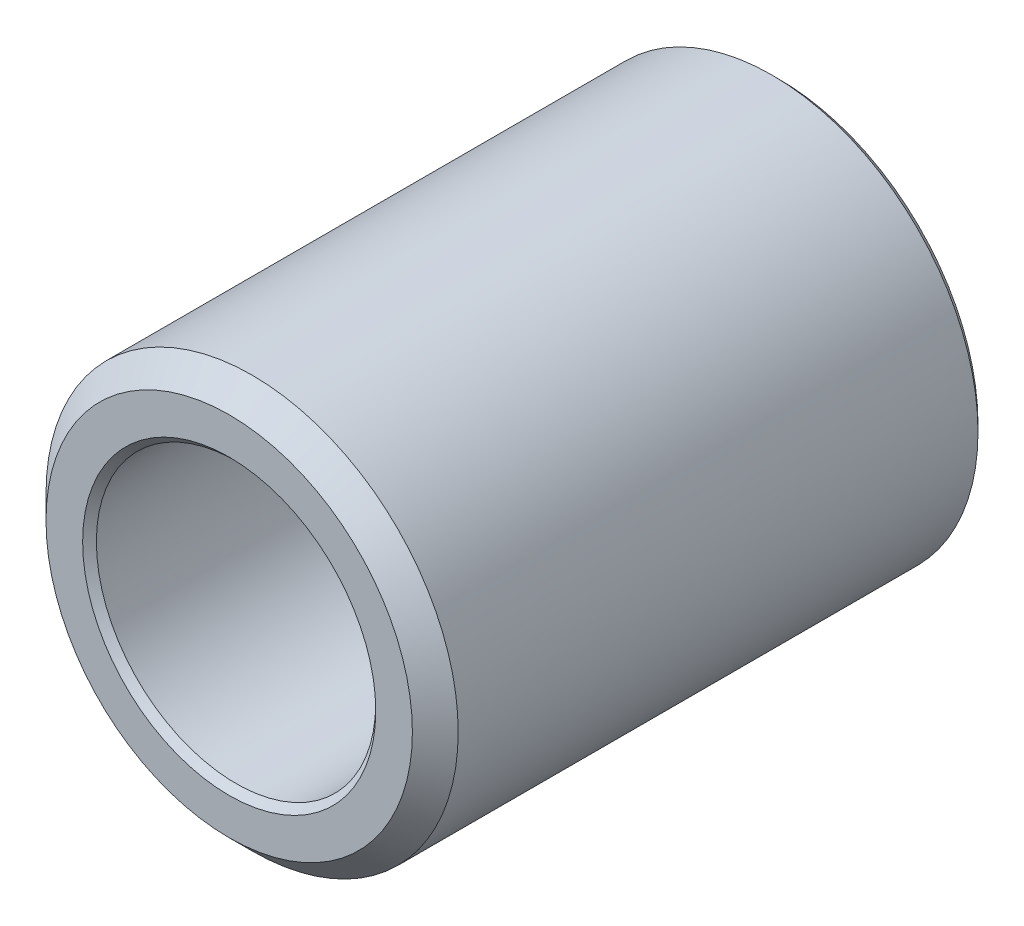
SolidWorks part; units mm, degrees
ref_plane "Спереди" through (0, 0, 0) normal (0, 0, 1) x (1, 0, 0)
ref_plane "Сверху" through (0, 0, 0) normal (0, 1, 0) x (1, 0, 0)
ref_plane "Справа" through (0, 0, 0) normal (1, 0, 0) x (0, 0, -1)
sketch "Эскиз1" plane through (0, 0, 0) normal (0, 0, 1) x (1, 0, 0)
  circle A0 centre (0, 0) radius 4.5
  circle A1 centre (0, 0) radius 3.05
  dimension "D1" = 6.1
  dimension "D2" = 9
extrude "Бобышка-Вытянуть1" add sketch "Эскиз1" along normal blind 12
chamfer "Фаска1" distance 0.5 angle 45 1 edges at (4.5, 0, 12)
chamfer "Фаска2" distance 0.15 angle 45 3 edges at (3.05, 0, 0) (3.05, 0, 12) (4.5, 0, 0)
